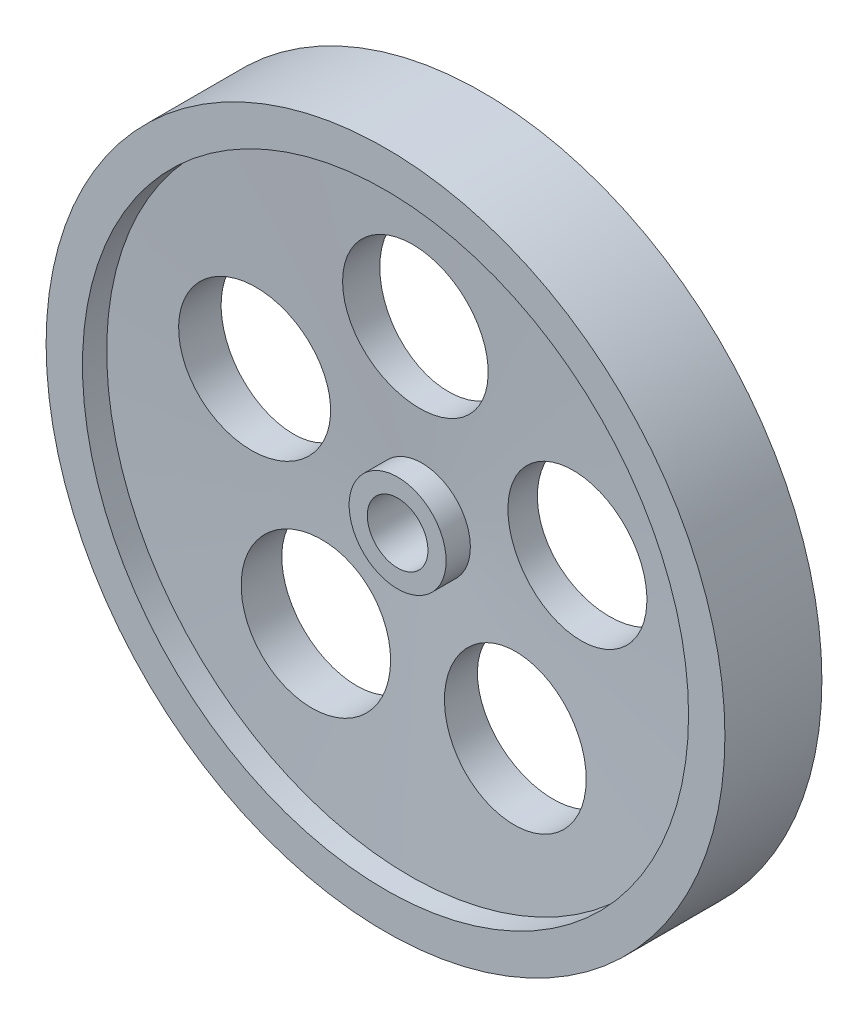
SolidWorks part; units mm, degrees
ref_plane "Front Plane" through (0, 0, 0) normal (0, 0, 1) x (1, 0, 0)
ref_plane "Top Plane" through (0, 0, 0) normal (0, 1, 0) x (1, 0, 0)
ref_plane "Right Plane" through (0, 0, 0) normal (1, 0, 0) x (0, 0, -1)
sketch "Sketch1" plane through (0, 0, 0) normal (1, 0, 0) x (0, 0, -1)
  line L0 (0, 0) -> (0, 177.8) construction
  line L1 (-19.05, 15.875) -> (-19.05, 25.4)
  line L2 (-19.05, 25.4) -> (-6.35, 25.4)
  line L3 (-6.35, 25.4) -> (-12.7, 158.75)
  line L4 (-25.4, 158.75) -> (-25.4, 177.8)
  line L5 (-25.4, 177.8) -> (25.4, 177.8)
  line L6 (-22.1514, 0) -> (22.1514, 0) construction
  line L7 (25.4, 158.75) -> (25.4, 177.8)
  line L8 (6.35, 25.4) -> (12.7, 158.75)
  line L9 (19.05, 25.4) -> (6.35, 25.4)
  line L10 (19.05, 15.875) -> (19.05, 25.4)
  line L11 (-19.05, 15.875) -> (19.05, 15.875)
  line L12 (-25.4, 158.75) -> (-12.7, 158.75)
  line L13 (12.7, 158.75) -> (25.4, 158.75)
  dimension "D1" = 50.8
  dimension "D2" = 19.05
  dimension "D3" = 12.7
  dimension "Hub ID" = 31.75
  dimension "D4" = 12.7
  dimension "Hub Width" = 38.1
  dimension "Hub OD" = 50.8
  dimension "Wheel Diameter" = 355.6
revolve "Revolve1" add sketch "Sketch1" angle 360 about L6
sketch "Circular Cut Sketch" plane through (0, 0, 0) normal (0, 0, 1) x (1, 0, 0)
  line L0 (0, 177.8) -> (0, 0) construction
  circle A0 centre (0, 88.9) radius 38.1
  circle A1 centre (0, 0) radius 177.8 construction
  dimension "Circular Spoke Diameter" = 76.2
extrude "Cut-Extrude1" cut sketch "Circular Cut Sketch" against normal through all and the other way through all
pattern_circular "Circle Pattern" count 5 over 360 about axis through (0, 0, 0) along (0, 0, 1) of "Cut-Extrude1"
sketch "Spoke Cut Sketch" plane through (0, 0, 0) normal (0, 0, 1) x (1, 0, 0)
  line L0 (0, 0) -> (0, 141.4028) construction
  line L1 (-17.3746, 38.2644) -> (-57.3636, 116.6658)
  line L2 (17.3746, 38.2644) -> (57.3636, 116.6658)
  circle A2 centre (0, 0) radius 143.51
  arc A3 (50.5211, 134.3233) -> (-50.5211, 134.3233) centre (0, 0) ccw
  arc A4 (-57.3636, 116.6658) -> (-50.5211, 134.3233) centre (-46.0502, 122.4363) cw
  circle A5 centre (0, 0) radius 31.75
  arc A6 (4.3295, 31.4534) -> (-4.3295, 31.4534) centre (0, 0) ccw
  arc A7 (57.3636, 116.6658) -> (50.5211, 134.3233) centre (46.0502, 122.4363) ccw
  arc A8 (-17.3746, 38.2644) -> (-4.3295, 31.4534) centre (-6.0613, 44.0348) ccw
  arc A9 (17.3746, 38.2644) -> (4.3295, 31.4534) centre (6.0613, 44.0348) cw
  point P14 (-63.5, 128.6968)
  point P17 (63.5, 128.6968)
  point P19 (-12.7, 29.0994)
  point P22 (12.7, 29.0994)
  dimension "D5" = 12.7
  dimension "D6" = 12.7
  dimension "D3" = 25.4
  dimension "D4" = 127
  dimension "D1" = 15.24
  dimension "D2" = 6.35
extrude "Cut-Extrude2" cut sketch "Spoke Cut Sketch" against normal through all and the other way through all
pattern_circular "Spoke Pattern" count 5 over 360
